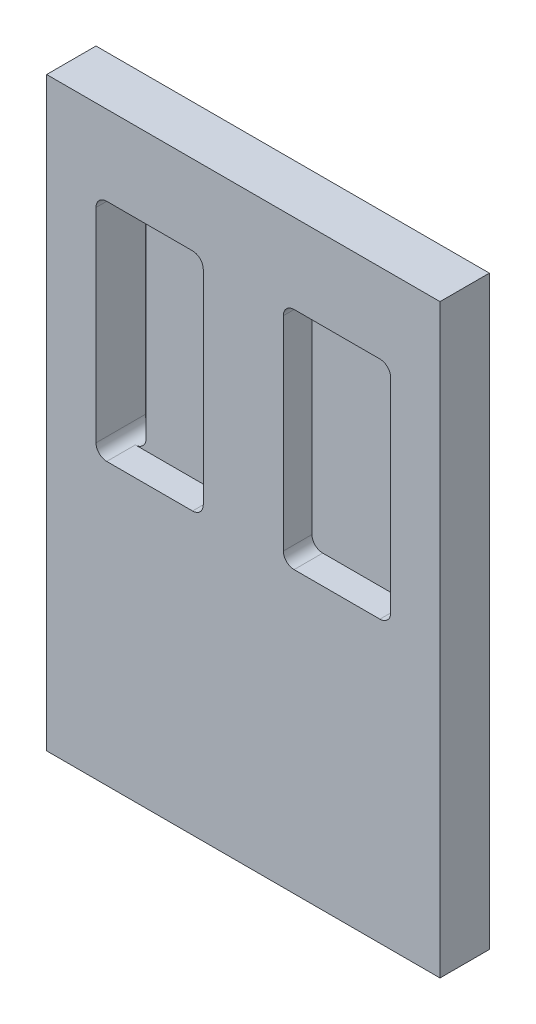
SolidWorks part; units mm, degrees
ref_plane "Front Plane" through (0, 0, 0) normal (0, 0, 1) x (1, 0, 0)
ref_plane "Top Plane" through (0, 0, 0) normal (0, 1, 0) x (1, 0, 0)
ref_plane "Right Plane" through (0, 0, 0) normal (1, 0, 0) x (0, 0, -1)
sketch "Sketch1" plane through (0, 0, 0) normal (0, 0, 1) x (1, 0, 0)
  line L0 (10.668, 87.9475) -> (10.668, 51.7525) construction
  line L1 (0, 0) -> (69.85, 0)
  line L2 (0, 0) -> (0, 104.013)
  line L3 (0, 104.013) -> (69.85, 104.013)
  line L4 (69.85, 0) -> (69.85, 104.013)
  line L5 (12.573, 87.9475) -> (12.573, 51.7525)
  line L6 (8.763, 87.9475) -> (8.763, 51.7525)
  line L7 (59.182, 87.9475) -> (59.182, 51.7525) construction
  line L8 (61.087, 87.9475) -> (61.087, 51.7525)
  line L9 (57.277, 87.9475) -> (57.277, 51.7525)
  arc A0 (12.573, 87.9475) -> (8.763, 87.9475) centre (10.668, 87.9475) ccw
  arc A1 (8.763, 51.7525) -> (12.573, 51.7525) centre (10.668, 51.7525) ccw
  arc A2 (61.087, 87.9475) -> (57.277, 87.9475) centre (59.182, 87.9475) ccw
  arc A3 (57.277, 51.7525) -> (61.087, 51.7525) centre (59.182, 51.7525) ccw
  point P7 (10.668, 69.85)
  point P12 (59.182, 69.85)
  dimension "D1" = 104.013
  dimension "D2" = 69.85
extrude "Boss-Extrude1" add sketch "Sketch1" along normal blind 8.763
sketch "Sketch2" plane through (0, 0, 8.763) normal (0, 0, 1) x (1, 0, 0)
  line L0 (10.668, 89.8525) -> (25.908, 89.8525)
  line L1 (10.668, 49.8475) -> (25.908, 49.8475)
  line L2 (34.925, 103.7629) -> (34.925, 43.3295) construction
  line L3 (8.763, 87.9475) -> (8.763, 51.7525)
  line L4 (27.813, 87.9475) -> (27.813, 51.7525)
  line L5 (0, 0) -> (0, 104.013) construction
  line L6 (42.037, 87.9475) -> (42.037, 51.7525)
  line L7 (61.087, 87.9475) -> (61.087, 51.7525)
  line L8 (59.182, 49.8475) -> (43.942, 49.8475)
  line L9 (59.182, 89.8525) -> (43.942, 89.8525)
  arc A0 (59.182, 89.8525) -> (61.087, 87.9475) centre (59.182, 87.9475) cw
  arc A1 (42.037, 87.9475) -> (43.942, 89.8525) centre (43.942, 87.9475) cw
  arc A2 (10.668, 49.8475) -> (8.763, 51.7525) centre (10.668, 51.7525) cw
  arc A3 (25.908, 49.8475) -> (27.813, 51.7525) centre (25.908, 51.7525) ccw
  arc A4 (27.813, 87.9475) -> (25.908, 89.8525) centre (25.908, 87.9475) ccw
  arc A5 (10.668, 89.8525) -> (8.763, 87.9475) centre (10.668, 87.9475) ccw
  arc A6 (43.942, 49.8475) -> (42.037, 51.7525) centre (43.942, 51.7525) cw
  arc A7 (59.182, 49.8475) -> (61.087, 51.7525) centre (59.182, 51.7525) ccw
  dimension "D3" = 1.905
  dimension "D1" = 34.925
  dimension "D2" = 19.05
extrude "Cut-Extrude1" cut sketch "Sketch2" against normal blind 5.08
